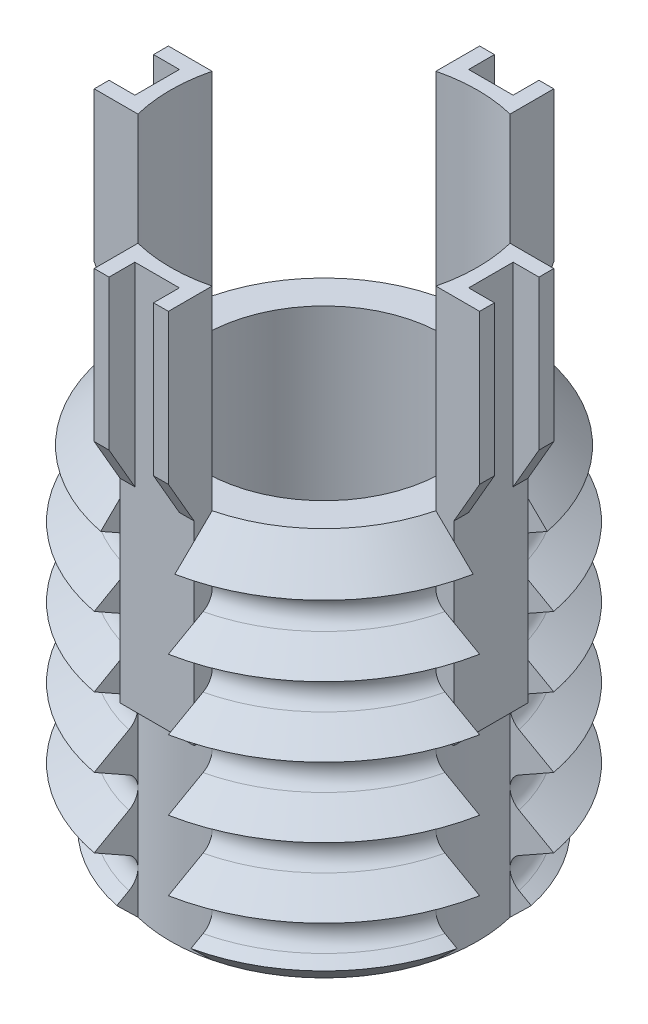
SolidWorks part; units mm, degrees
ref_plane "Front Plane" through (0, 0, 0) normal (0, 0, 1) x (1, 0, 0)
ref_plane "Top Plane" through (0, 0, 0) normal (0, 1, 0) x (1, 0, 0)
ref_plane "Right Plane" through (0, 0, 0) normal (1, 0, 0) x (0, 0, -1)
sketch "Sketch1" plane through (0, 0, 0) normal (0, 1, 0) x (1, 0, 0)
  circle A0 centre (0, 0) radius 3.969
  circle A1 centre (0, 0) radius 2.413
  dimension "D1" = 4.826
  dimension "D2" = 7.938
extrude "Boss-Extrude1" add sketch "Sketch1" along normal mid plane 7.87
sketch "Sketch2" plane through (0, 3.935, 0) normal (0, 1, 0) x (1, 0, 0)
  circle A0 centre (0, 0) radius 3.105
  dimension "D1" = 6.21
extrude "Cut-Extrude1" cut sketch "Sketch2" against normal through all draft 45 flip side to cut
mirror "Mirror1" about plane through (0, 0, 0) normal (0, 1, 0) of "Cut-Extrude1"
sketch "Sketch3" plane through (0, 3.935, 0) normal (0, 1, 0) x (1, 0, 0)
  line L0 (-3.969, 0) -> (-3.969, 0.75)
  line L1 (-3.969, 0.75) -> (-3.0131, 0.75)
  line L2 (-3.969, 0) -> (-3.969, -0.75)
  line L3 (-3.969, -0.75) -> (-3.0131, -0.75)
  arc A0 (-3.0131, 0.75) -> (-3.0131, -0.75) centre (0, 0) ccw
  circle A1 centre (0, 0) radius 3.105 construction
  circle A2 centre (0, 0) radius 3.969 construction
  dimension "D1" = 1.5
extrude "Cut-Extrude2" cut sketch "Sketch3" against normal through all
sketch "Sketch4" plane through (0, 0, 0) normal (0, 0, 1) x (1, 0, 0)
  line L1 (3.969, -3.071) -> (3.969, -3.776)
  line L3 (3.969, -3.776) -> (3.2835, -3.3803)
  line L6 (3.2835, -2.7617) -> (3.969, -2.366)
  line L10 (3.969, -3.071) -> (3.969, 3.071) construction
  line L12 (3.969, -2.366) -> (3.969, -3.071)
  arc A1 (3.2835, -3.3803) -> (3.2835, -2.7617) centre (3.4621, -3.071) cw
  point P5 (3.105, -3.935)
  point P9 (3.105, -3.071)
  dimension "D2" = 60
  dimension "D1" = 1.41
revolve "Cut-Revolve1" cut sketch "Sketch4" angle 360 about axis through (0, 3.935, 0) along (0, -1, 0)
pattern_linear "LPattern1" count 5 spacing 1.41 along (0, 1, 0) of "Cut-Revolve1"
sketch "Sketch5" plane through (0, 3.935, 0) normal (0, -1, 0) x (1, 0, 0)
  line L0 (-3.0131, 0.75) -> (-3.8975, 0.75)
  line L1 (-3.0131, -0.75) -> (-3.8975, -0.75)
  line L2 (-3.3751, -0.45) -> (-3.8975, -0.45)
  line L3 (-3.3751, 0.45) -> (-3.8975, 0.45)
  line L4 (-3.8975, 0.75) -> (-3.8975, 0.45)
  line L5 (-3.8975, -0.45) -> (-3.8975, -0.75)
  line L6 (-3.3751, 0.45) -> (-3.3751, -0.45)
  arc A0 (-3.0131, 0.75) -> (-3.0131, -0.75) centre (0, 0) ccw
  arc A1 (-3.0131, 0.75) -> (-3.0131, -0.75) centre (0, 0) ccw construction
  arc A3 (-3.3751, 0.45) -> (-3.3751, -0.45) centre (0, 0) ccw construction
  dimension "D1" = 0.3
extrude "Boss-Extrude2" add sketch "Sketch5" along normal mid plane 7.87
sketch "Sketch6" plane through (0, 0, 0) normal (0, 0, 1) x (1, 0, 0)
  line L9 (-3.3751, 3.935) -> (-3.8975, 4.8398)
  line L10 (-3.3751, 0) -> (-3.3751, 7.87) construction
  line L11 (-3.8975, 0) -> (-3.8975, 7.87) construction
  line L12 (-3.8975, 4.8398) -> (-3.8975, 0)
  line L13 (-3.8975, 0) -> (-3.3751, 0)
  line L15 (-3.3751, 0) -> (-3.3751, 3.935)
  line L16 (2.413, 3.935) -> (-2.413, 3.935) construction
  dimension "D1" = 150
extrude "Cut-Extrude3" cut sketch "Sketch6" against normal mid plane 1.5
pattern_circular "CirPattern1" count 4 over 360 about axis through (0, 0, 0) along (0, 1, 0) of "Cut-Extrude2", "Boss-Extrude2", "Cut-Extrude3"
